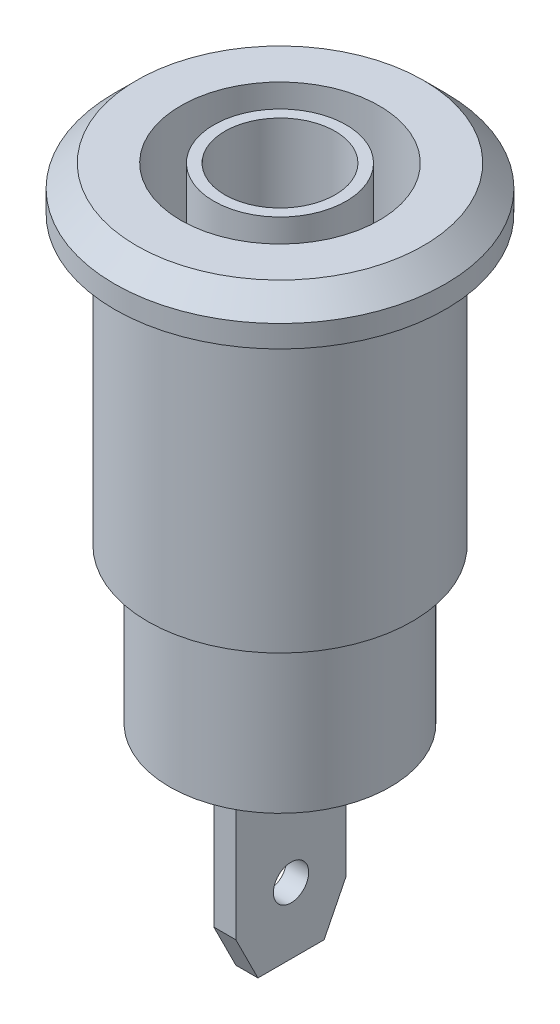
SolidWorks part; units mm, degrees
ref_plane "Plan1" through (0, 0, 0) normal (0, 0, 1) x (1, 0, 0)
ref_plane "Plan2" through (0, 0, 0) normal (0, 1, 0) x (1, 0, 0)
ref_plane "Plan3" through (0, 0, 0) normal (1, 0, 0) x (0, 0, -1)
sketch "Esquisse1" plane through (0, 0, 0) normal (1, 0, 0) x (0, 0, -1)
  line L0 (0, 0) -> (7.5, 0)
  line L1 (7.5, 0) -> (7.5, -2)
  line L2 (7.5, -2) -> (6, -2)
  line L3 (6, -2) -> (6, -15)
  line L4 (6, -15) -> (5, -15)
  line L5 (5, -15) -> (5, -22)
  line L6 (5, -22) -> (0, -22)
  line L7 (0, -22) -> (0, 0)
  line L8 (0, 10) -> (0, -30) construction
revolve "Base-Révolution" add sketch "Esquisse1" angle 360 about L8
chamfer "Chanfrein1" distance 1 angle 45
sketch "Esquisse2" plane through (0, 0, 0) normal (0, 1, 0) x (-1, 0, 0)
  circle A0 centre (0, 0) radius 4.5
extrude "Enlèv. mat.-Extru.1" cut sketch "Esquisse2" against normal blind 12
sketch "Esquisse3" plane through (0, -12, 0) normal (0, 1, 0) x (-1, 0, 0)
  circle A0 centre (0, 0) radius 3
extrude "Boss.-Extru.1" add sketch "Esquisse3" along normal blind 12
sketch "Esquisse4" plane through (0, 0, 0) normal (0, 1, 0) x (-1, 0, 0)
  circle A0 centre (0, 0) radius 2.5
extrude "Enlèv. mat.-Extru.2" cut sketch "Esquisse4" against normal blind 12
ref_plane "Plan4" through (0.5, 0, 0) normal (1, 0, 0) x (0, 0, -1)
sketch "Esquisse5" plane through (0.5, 0, 0) normal (1, 0, 0) x (0, 0, -1)
  line L0 (-5, -22) -> (5, -22) construction
  line L1 (-2.5, -22) -> (2.5, -22)
  line L2 (-2.5, -22) -> (-2.5, -31)
  line L3 (-2.5, -31) -> (2.5, -31)
  line L4 (2.5, -22) -> (2.5, -31)
extrude "Boss.-Extru.2" add sketch "Esquisse5" against normal blind 1
sketch "Esquisse6" plane through (0.5, 0, 0) normal (1, 0, 0) x (0, 0, -1)
  line L0 (-2.5, -29) -> (-1.5, -31)
  line L1 (-2.5, -22) -> (-2.5, -31) construction
  line L2 (-2.5, -31) -> (2.5, -31) construction
  line L3 (-1.5, -31) -> (-2.5, -31)
  line L4 (-2.5, -31) -> (-2.5, -29)
extrude "Enlèv. mat.-Extru.3" cut sketch "Esquisse6" against normal blind 1
sketch "Esquisse7" plane through (0.5, 0, 0) normal (1, 0, 0) x (0, 0, -1)
  line L0 (2.5, -31) -> (2.5, -29)
  line L1 (2.5, -31) -> (2.5, -22) construction
  line L2 (2.5, -29) -> (1.5, -31)
  line L3 (-1.5, -31) -> (2.5, -31) construction
  line L4 (1.5, -31) -> (2.5, -31)
extrude "Enlèv. mat.-Extru.4" cut sketch "Esquisse7" against normal blind 1
sketch "Esquisse8" plane through (0.5, 0, 0) normal (1, 0, 0) x (0, 0, -1)
  circle A0 centre (0, -28) radius 0.8
extrude "Enlèv. mat.-Extru.5" cut sketch "Esquisse8" against normal blind 1
